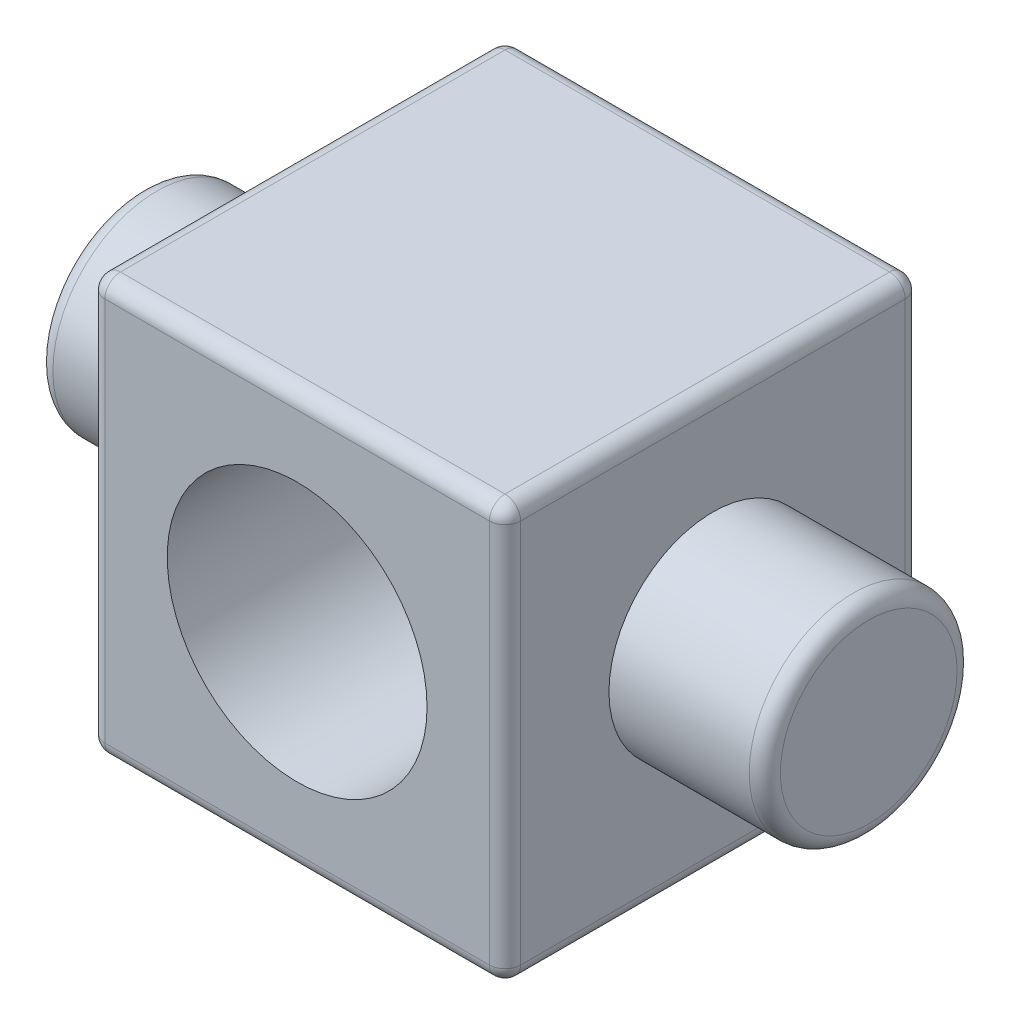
SolidWorks part; units mm, degrees
ref_plane "Plan de face" through (0, 0, 0) normal (0, 0, 1) x (1, 0, 0)
ref_plane "Plan de dessus" through (0, 0, 0) normal (0, 1, 0) x (1, 0, 0)
ref_plane "Plan de droite" through (0, 0, 0) normal (1, 0, 0) x (0, 0, -1)
sketch "Esquisse1" plane through (0, 0, 0) normal (0, 0, 1) x (1, 0, 0)
  line L1 (0, 0) -> (80, 0)
  line L2 (0, 0) -> (0, 80)
  line L3 (0, 80) -> (80, 80)
  line L4 (80, 0) -> (80, 80)
  circle A0 centre (40, 40) radius 25
  dimension "D3" = 50
  dimension "D1" = 80
  dimension "D2" = 80
  dimension "D4" = 40
  dimension "D5" = 40
extrude "Boss.-Extru.1" add sketch "Esquisse1" along normal blind 80
sketch "Esquisse2" plane through (80, 0, 0) normal (1, 0, 0) x (0, 0, -1)
  line L0 (-80, 80) -> (0, 80) construction
  line L1 (0, 0) -> (0, 80) construction
  circle A0 centre (-40, 40) radius 20
  dimension "D1" = 40
  dimension "D2" = 40
  dimension "D3" = 40
extrude "Boss.-Extru.2" add sketch "Esquisse2" along normal blind 30
sketch "Esquisse3" plane through (0, 0, 0) normal (-1, 0, 0) x (0, 0, 1)
  line L0 (80, 80) -> (0, 80) construction
  line L1 (80, 80) -> (80, 0) construction
  circle A0 centre (40, 40) radius 20
  dimension "D1" = 40
  dimension "D2" = 40
  dimension "D3" = 40
extrude "Boss.-Extru.3" add sketch "Esquisse3" along normal blind 30
fillet "Congé1" radius 3 14 edges at (0, 0, 40) (40, 0, 80) (0, 40, 80) (40, 80, 80) (80, 40, 80) (0, 40, 0) (80, 0, 40) (40, 0, 0) (80, 40, 0) (80, 80, 40) (40, 80, 0) (-30, 40, 60) (0, 80, 40) (110, 40, 20)
